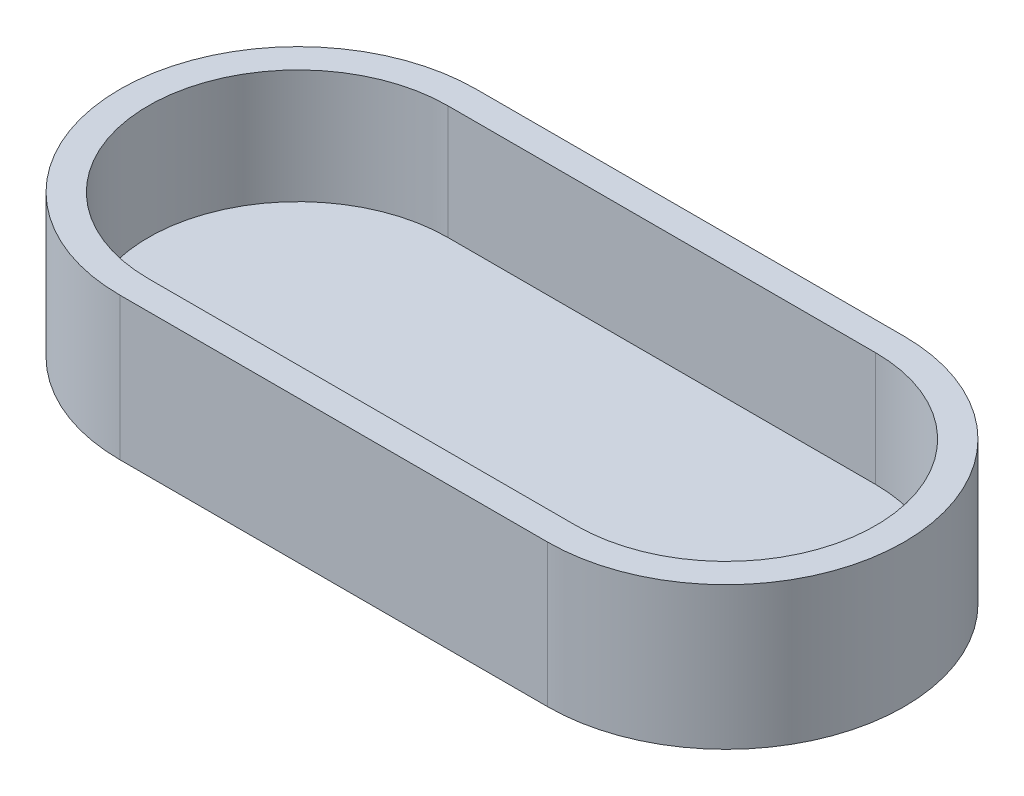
SolidWorks part; units mm, degrees
ref_plane "Front Plane" through (0, 0, 0) normal (0, 0, 1) x (1, 0, 0)
ref_plane "Top Plane" through (0, 0, 0) normal (0, 1, 0) x (1, 0, 0)
ref_plane "Right Plane" through (0, 0, 0) normal (1, 0, 0) x (0, 0, -1)
sketch "Sketch2" plane through (0, 0, 0) normal (0, 1, 0) x (1, 0, 0)
  line L0 (0, 0) -> (60, 0)
  line L1 (60, 50) -> (0, 50)
  arc A0 (60, 0) -> (60, 50) centre (60, 25) ccw
  arc A1 (0, 50) -> (0, 0) centre (0, 25) ccw
  dimension "D2" = 25
  dimension "D1" = 60
extrude "Extrude1" add sketch "Sketch2" along normal blind 20
shell "Shell1" thickness 4
